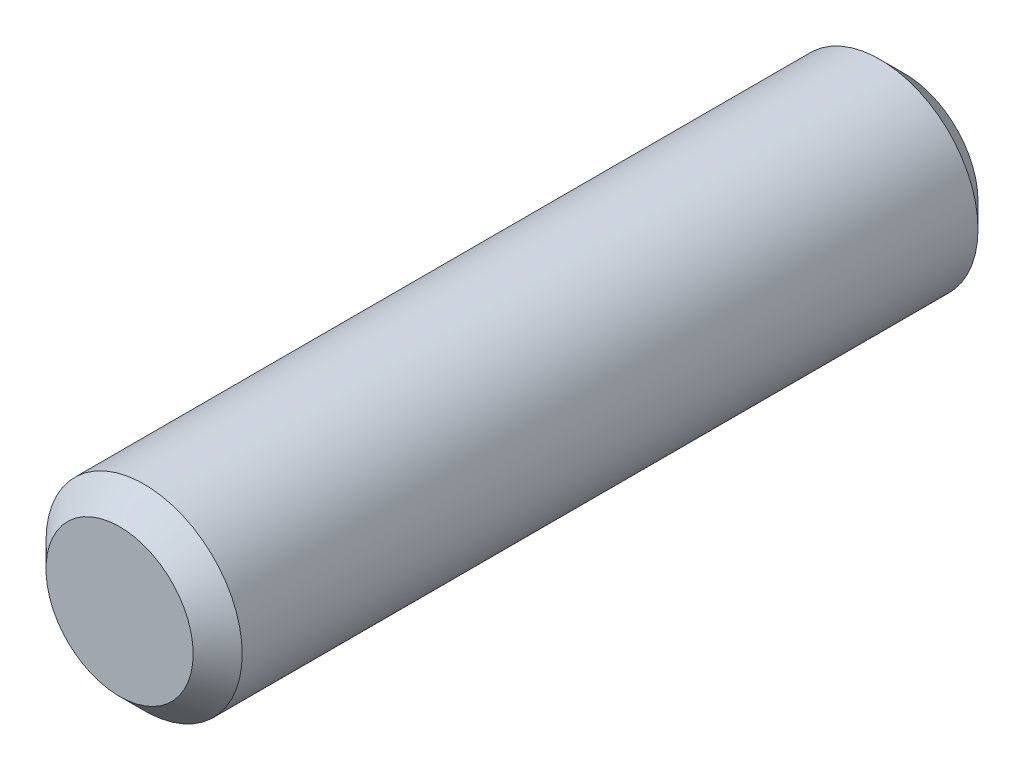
SolidWorks part; units mm, degrees
ref_plane "Plan de face" through (0, 0, 0) normal (0, 0, 1) x (1, 0, 0)
ref_plane "Plan de dessus" through (0, 0, 0) normal (0, 1, 0) x (1, 0, 0)
ref_plane "Plan de droite" through (0, 0, 0) normal (1, 0, 0) x (0, 0, -1)
sketch "Esquisse1" plane through (0, 0, 0) normal (0, 0, 1) x (1, 0, 0)
  circle A0 centre (0, 0) radius 2
  dimension "D1" = 4
extrude "Boss.-Extru.1" add sketch "Esquisse1" along normal blind 16
chamfer "Chanfrein1" distance 0.5 angle 45 2 edges at (2, 0, 0) (2, 0, 16)
